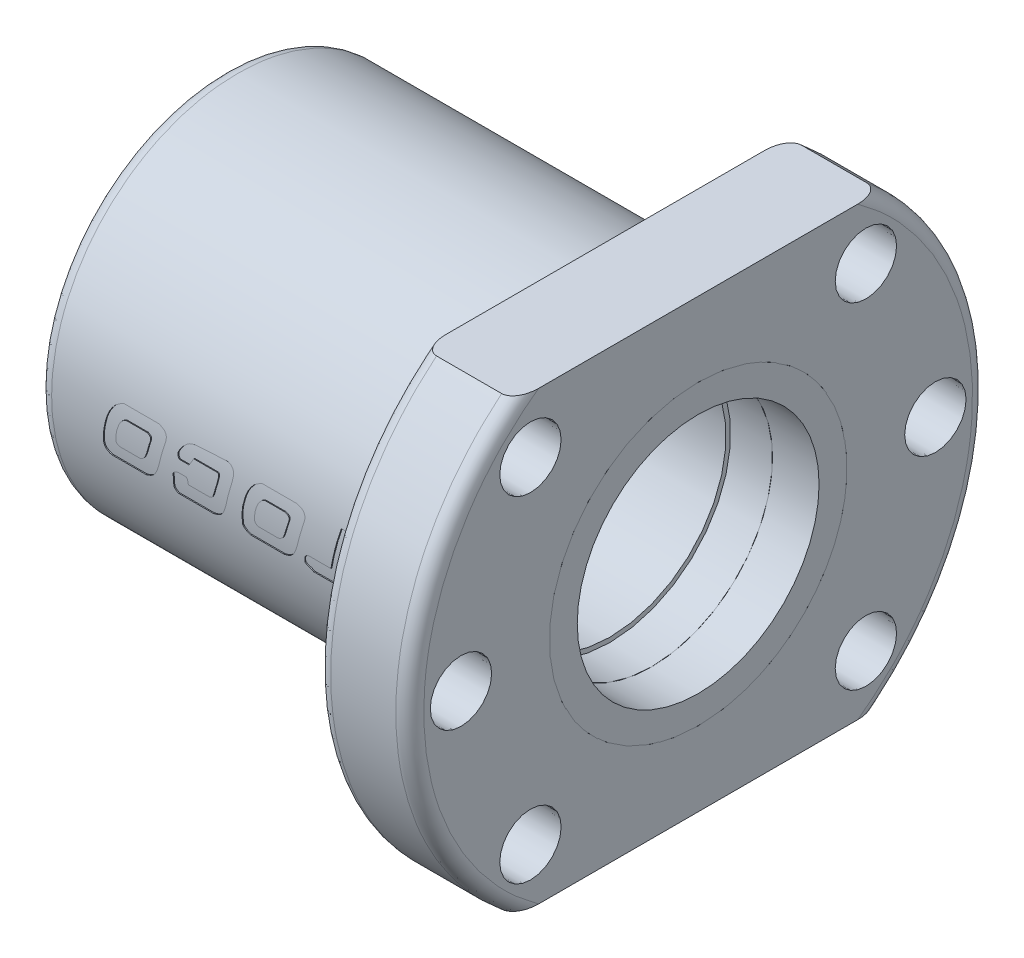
SolidWorks part; units mm, degrees
other "____1[2]"
other "____1[1]"
ref_plane "Front Plane" through (0, 0, 0) normal (0, 0, 1) x (1, 0, 0)
ref_plane "Top Plane" through (0, 0, 0) normal (0, 1, 0) x (1, 0, 0)
ref_plane "Right Plane" through (0, 0, 0) normal (1, 0, 0) x (0, 0, -1)
imported_body "Imported1"
imported_body "Imported2"
sketch "Sketch1" plane through (0, 0, 0) normal (1, 0, 0) x (0, 0, -1)
  circle A0 centre (0, 0) radius 12.5
extrude "Cut-Extrude1" cut sketch "Sketch1" against normal up to surface (82 mm away)
